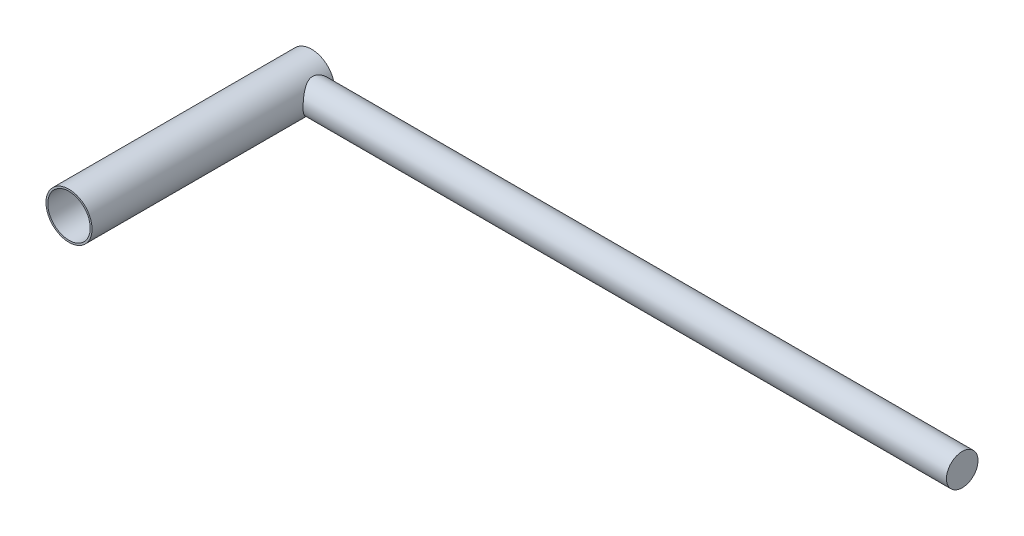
SolidWorks part; units mm, degrees
ref_plane "Alzado" through (0, 0, 0) normal (0, 0, 1) x (1, 0, 0)
ref_plane "Planta" through (0, 0, 0) normal (0, 1, 0) x (1, 0, 0)
ref_plane "Vista lateral" through (0, 0, 0) normal (1, 0, 0) x (0, 0, -1)
sketch "Croquis1" plane through (0, 0, 0) normal (0, 0, 1) x (1, 0, 0)
  circle A0 centre (0, 0) radius 19
  dimension "D1" = 38
extrude "Saliente-Extruir1" add sketch "Croquis1" along normal blind 200
sketch "Croquis2" plane through (0, 0, 0) normal (1, 0, 0) x (0, 0, -1)
  circle A0 centre (-13, 0) radius 13
  dimension "D1" = 26
  dimension "D2" = 13
extrude "Saliente-Extruir2" add sketch "Croquis2" along normal blind 549.452
sketch "Croquis3" plane through (0, 0, 0) normal (0, 0, 1) x (1, 0, 0)
  line L0 (549.452, -13) -> (549.452, 13) construction
  circle A0 centre (538.276, 0) radius 4.7625
  circle A1 centre (512.876, 0) radius 4.7625
  circle A2 centre (487.476, 0) radius 4.7625
  circle A3 centre (462.076, 0) radius 4.7625
  circle A4 centre (436.676, 0) radius 4.7625
  circle A5 centre (411.276, 0) radius 4.7625
  circle A6 centre (385.876, 0) radius 4.7625
  circle A7 centre (360.476, 0) radius 4.7625
  circle A8 centre (335.076, 0) radius 4.7625
  circle A9 centre (309.676, 0) radius 4.7625
  circle A10 centre (284.276, 0) radius 4.7625
  circle A11 centre (258.876, 0) radius 4.7625
  circle A12 centre (233.476, 0) radius 4.7625
  circle A13 centre (208.076, 0) radius 4.7625
  circle A14 centre (182.676, 0) radius 4.7625
  circle A15 centre (157.276, 0) radius 4.7625
  circle A16 centre (131.876, 0) radius 4.7625
  circle A17 centre (106.476, 0) radius 4.7625
  circle A18 centre (81.076, 0) radius 4.7625
  circle A19 centre (55.676, 0) radius 4.7625
  circle A20 centre (30.276, 0) radius 4.7625
  circle A21 centre (4.876, 0) radius 4.7625
  dimension "D1" = 9.525
  dimension "D2" = 11.176
  dimension "D3" = 22
extrude "Cortar-Extruir2" cut sketch "Croquis3" along normal blind 23
sketch "Croquis4" plane through (0, 0, 0) normal (1, 0, 0) x (0, 0, -1)
  circle A0 centre (-13, 0) radius 11.5
  dimension "D2" = 23
  dimension "D1" = 13
extrude "Cortar-Extruir3" cut sketch "Croquis4" along normal blind 546
sketch "Croquis5" plane through (0, 0, 200) normal (0, 0, 1) x (1, 0, 0)
  circle A0 centre (0, 0) radius 17.5
  dimension "D1" = 35
extrude "Cortar-Extruir4" cut sketch "Croquis5" against normal blind 198
